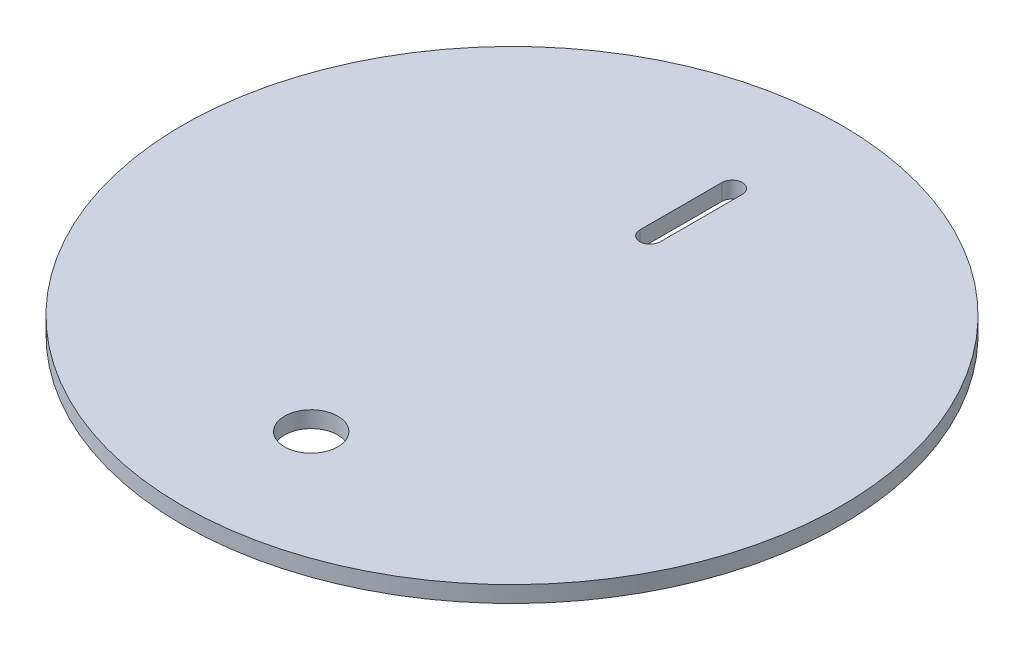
SolidWorks part; units mm, degrees
ref_plane "Front Plane" through (0, 0, 0) normal (0, 0, 1) x (1, 0, 0)
ref_plane "Top Plane" through (0, 0, 0) normal (0, 1, 0) x (1, 0, 0)
ref_plane "Right Plane" through (0, 0, 0) normal (1, 0, 0) x (0, 0, -1)
sketch "Sketch1" plane through (0, 0, 0) normal (0, 1, 0) x (1, 0, 0)
  circle A0 centre (0, 0) radius 80.4
  dimension "D1" = 160.8
extrude "Boss-Extrude1" add sketch "Sketch1" along normal blind 4
sketch "Sketch4" plane through (0, 0, 0) normal (0, -1, 0) x (1, 0, 0)
  line L0 (0, 80.4) -> (0, -80.4) construction
  line L1 (-80.4, 0) -> (80.4, 0) construction
  line L2 (0, -33.7008) -> (0, -53.7008) construction
  line L3 (2.5, -33.7008) -> (2.5, -53.7008)
  line L4 (-2.5, -33.7008) -> (-2.5, -53.7008)
  circle A0 centre (0, 0) radius 80.4 construction
  circle A1 centre (0, 48.986) radius 6.5
  arc A2 (2.5, -33.7008) -> (-2.5, -33.7008) centre (0, -33.7008) ccw
  arc A3 (-2.5, -53.7008) -> (2.5, -53.7008) centre (0, -53.7008) ccw
  point P11 (0, -43.7008)
  dimension "D1" = 13
  dimension "D3" = 2.5
  dimension "D2" = 20
extrude "Cut-Extrude2" cut sketch "Sketch4" against normal through all
